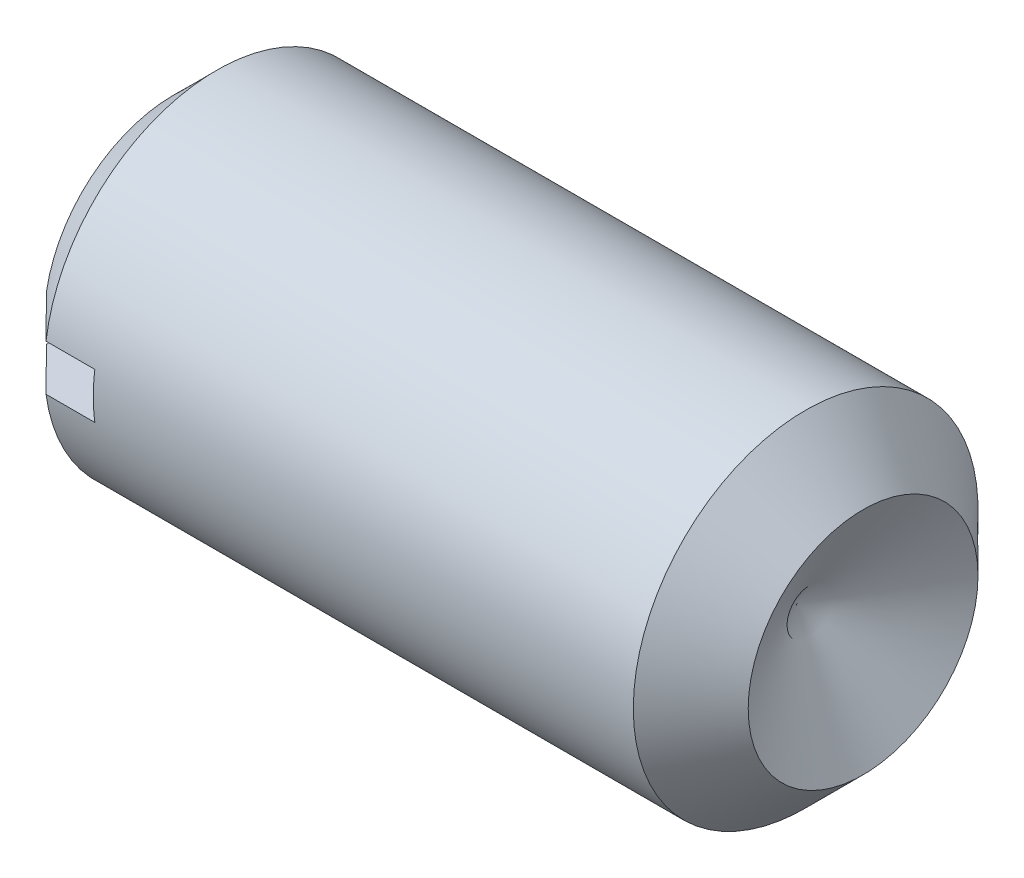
SolidWorks part; units mm, degrees
ref_plane "Front" through (0, 0, 0) normal (0, 0, 1) x (1, 0, 0)
ref_plane "Top" through (0, 0, 0) normal (0, 1, 0) x (1, 0, 0)
ref_plane "Right" through (0, 0, 0) normal (1, 0, 0) x (0, 0, -1)
sketch "Sketch1" plane through (0, 0, 0) normal (0, 0, 1) x (1, 0, 0)
  line L0 (0, 0) -> (5.4226, 0)
  line L2 (6, 1) -> (5.5, 1.5)
  line L3 (5.5, 1.5) -> (0.375, 1.5)
  line L4 (0.375, 1.5) -> (0, 1.125)
  line L5 (0, 1.125) -> (0, 0)
  line L6 (-10.745, 0) -> (0.8952, 0) construction
  line L7 (6, 1) -> (5.4226, 0)
  dimension "D1" = 45
  dimension "l" = 6
  dimension "D2" = 45
  dimension "dz" = 2
  dimension "D3" = 60
  dimension "d" = 3
  dimension "df" = 2.25
revolve "Base" add sketch "Sketch1" angle 360 about L6
sketch "Sketch2" plane through (0, 0, 0) normal (0, 0, 1) x (1, 0, 0)
  line L1 (0, 0.2) -> (0.8, 0.2)
  line L2 (0, 0.2) -> (0, -0.2)
  line L3 (0, -0.2) -> (0.8, -0.2)
  line L4 (0.8, 0.2) -> (0.8, -0.2)
  line L5 (0, 1.125) -> (0, -1.125) construction
  dimension "m" = 0.2
  dimension "n" = 0.4
  dimension "t" = 0.8
extrude "Notch" cut sketch "Sketch2" against normal through all and the other way through all
sketch "Sketch3" plane through (0, 0, 0) normal (0, 0, 1) x (1, 0, 0)
  line L0 (0.375, 1.1752) -> (0.5625, 1.5)
  line L1 (0.5625, 1.5) -> (0.5625, 1.875)
  line L2 (0.5625, 1.875) -> (0.1875, 1.875)
  line L3 (0.1875, 1.875) -> (0.1875, 1.5)
  line L4 (0.1875, 1.5) -> (0.375, 1.1752)
  line L5 (0.375, 1.5) -> (0.375, 0.2) construction
  line L6 (0, 0) -> (3.2886, 0) construction
  dimension "D1" = 3
  dimension "D2" = 0.375
revolve "Cut-Revolve10" [suppressed] cut sketch "Sketch3" angle 360 about L6
pattern_linear "LPattern10" [suppressed] count 13 spacing 0.45 along (1, 0, 0)
equation "\"df@Sketch1\" = \"D2@ThreadCosmetic1\""
equation "\"m@Sketch2\" = \"n@Sketch2\" / 2"
equation "\"D1@Sketch3\" = \"d@Sketch1\""
equation "\"D2@Sketch3\" =  ( \"d@Sketch1\" - \"D2@ThreadCosmetic1\" )  / 2"
equation "\"D3@LPattern10\" = \"D2@Sketch3\" * 1.2"
equation "\"D1@LPattern10\" =  ( \"l@Sketch1\" -  ( \"d@Sketch1\" - \"df@Sketch1\" )  / 2 )  / \"D3@LPattern10\""
